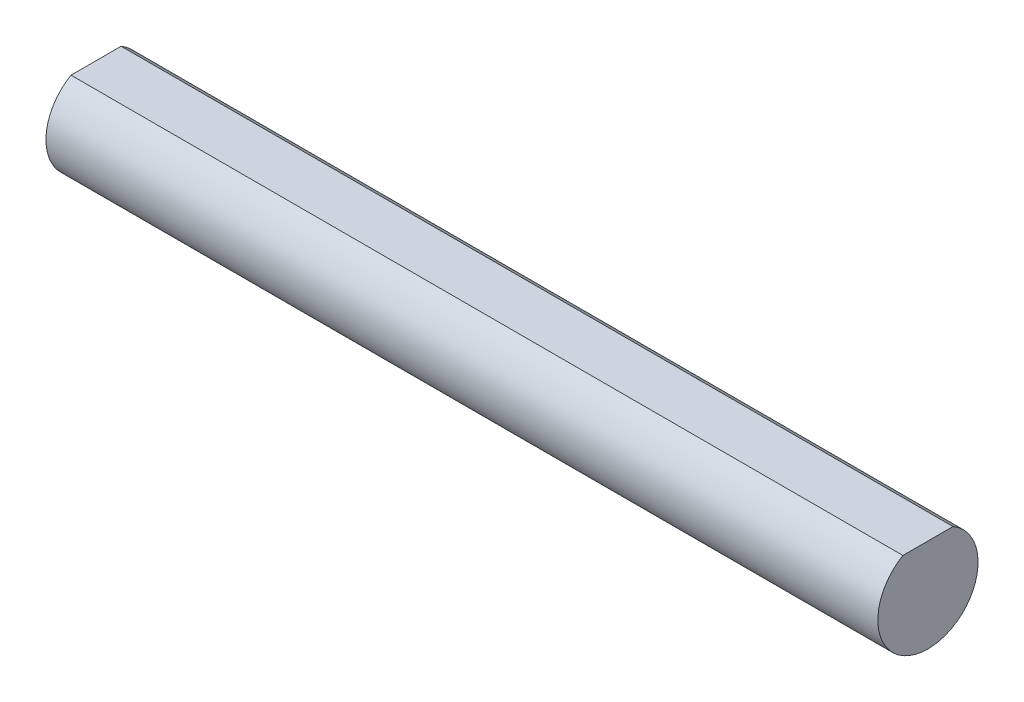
SolidWorks part; units mm, degrees
ref_plane "Front Plane" through (0, 0, 0) normal (0, 0, 1) x (1, 0, 0)
ref_plane "Top Plane" through (0, 0, 0) normal (0, 1, 0) x (1, 0, 0)
ref_plane "Right Plane" through (0, 0, 0) normal (1, 0, 0) x (0, 0, -1)
sketch "Sketch1" plane through (0, 0, 0) normal (1, 0, 0) x (0, 0, -1)
  line L1 (1.5, 2.5981) -> (-1.5, 2.5981)
  line L2 (-1.5, 2.5981) -> (-3, 0) construction
  line L3 (-3, 0) -> (-1.5, -2.5981) construction
  line L4 (-1.5, -2.5981) -> (1.5, -2.5981) construction
  line L5 (1.5, -2.5981) -> (3, 0) construction
  line L6 (3, 0) -> (1.5, 2.5981) construction
  circle A0 centre (0, 0) radius 2.5981 construction
  arc A1 (-1.5, 2.5981) -> (1.5, 2.5981) centre (0, 0) ccw
  dimension "D2" = 6
extrude "Boss-Extrude1" add sketch "Sketch1" along normal blind 49.8
